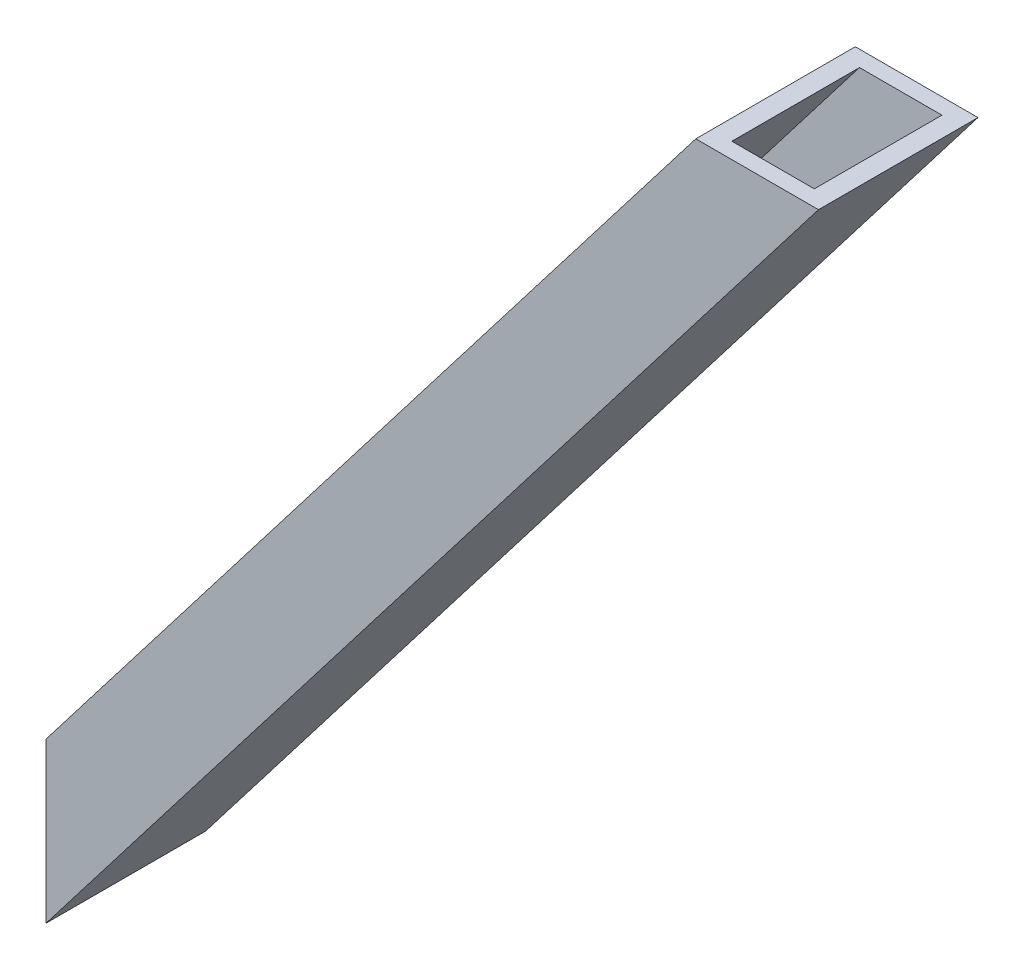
SolidWorks part; units mm, degrees
ref_plane "Plan de face" through (0, 0, 0) normal (0, 0, 1) x (1, 0, 0)
ref_plane "Plan de dessus" through (0, 0, 0) normal (0, 1, 0) x (1, 0, 0)
ref_plane "Plan de droite" through (0, 0, 0) normal (1, 0, 0) x (0, 0, -1)
sketch "Esquisse2" plane through (0, 0, 0) normal (0, 0, 1) x (1, 0, 0)
  line L0 (0, 0) -> (0, 20)
  line L1 (0, 20) -> (100, 150)
  line L2 (100, 150) -> (100, 130)
  line L3 (100, 130) -> (0, 0)
  dimension "D1" = 20
  dimension "D2" = 20
  dimension "D3" = 150
  dimension "D4" = 100
extrude "Boss.-Extru.1" add sketch "Esquisse2" along normal blind 20
shell "Coque1" thickness 2
sketch "Esquisse6" plane through (0, 0, 20) normal (0, 0, 1) x (1, 0, 0)
  line L0 (100, 130) -> (90.3346, 137.4349)
  line L1 (100, 150) -> (0, 20) construction
  line L2 (100, 130) -> (100, 150)
  line L3 (100, 150) -> (90.3346, 137.4349)
  dimension "D1" = 90
extrude "Enlèv. mat.-Extru.4" cut sketch "Esquisse6" against normal blind 21
sketch "Esquisse7" plane through (0, 0, 20) normal (0, 0, 1) x (1, 0, 0)
  line L0 (100, 130) -> (86.042, 131.8546)
  line L1 (90.3346, 137.4349) -> (0, 20) construction
  line L2 (0, 0) -> (100, 130) construction
  line L3 (86.042, 131.8546) -> (90.3346, 137.4349)
  line L4 (90.3346, 137.4349) -> (100, 130)
  dimension "D1" = 60
extrude "Enlèv. mat.-Extru.5" cut sketch "Esquisse7" against normal blind 21
sketch "Esquisse8" plane through (0, 0, 20) normal (0, 0, 1) x (1, 0, 0)
  line L0 (100, 130) -> (81.474, 125.9161)
  line L1 (86.042, 131.8546) -> (0, 20) construction
  line L2 (0, 0) -> (100, 130) construction
  line L3 (100, 130) -> (86.042, 131.8546)
  line L4 (86.042, 131.8546) -> (81.474, 125.9161)
  dimension "D1" = 40
extrude "Enlèv. mat.-Extru.6" cut sketch "Esquisse8" against normal blind 21
sketch "Esquisse9" plane through (0, 0, 20) normal (0, 0, 1) x (1, 0, 0)
  line L0 (81.474, 125.9161) -> (96.8586, 125.9161)
  line L1 (0, 0) -> (100, 130) construction
  line L2 (96.8586, 125.9161) -> (100, 130)
  line L3 (81.474, 125.9161) -> (100, 130) construction
  line L4 (100, 130) -> (81.474, 125.9161)
extrude "Enlèv. mat.-Extru.7" cut sketch "Esquisse9" against normal blind 21
